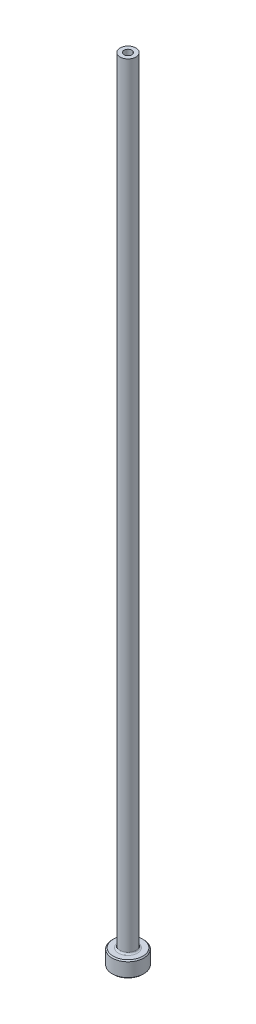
SolidWorks part; units mm, degrees
ref_plane "Front Plane" through (0, 0, 0) normal (0, 0, 1) x (1, 0, 0)
ref_plane "Top Plane" through (0, 0, 0) normal (0, 1, 0) x (1, 0, 0)
ref_plane "Right Plane" through (0, 0, 0) normal (1, 0, 0) x (0, 0, -1)
sketch "Sketch1" plane through (0, 0, 0) normal (0, 0, 1) x (1, 0, 0)
  line L0 (-0.75, 150) -> (-1.5, 150)
  line L1 (-1.5, 150) -> (-1.5, 3)
  line L2 (-1.5, 3) -> (-3, 3)
  line L3 (-3, 3) -> (-3, 0)
  line L4 (3.3, 0) -> (-3.3, 0) construction
  line L5 (-3, 0) -> (-1, 0)
  line L6 (-0.75, 115) -> (-0.75, 150)
  line L7 (0, 92.1877) -> (0, -15.5353) construction
  line L8 (0, -3.3) -> (0, 3.3) construction
  line L9 (-0.75, 115) -> (-1, 103)
  line L10 (-1, 103) -> (-1, 0)
  dimension "D1" = 0.25
  dimension "ID" = 1.5
  dimension "OD" = 3
  dimension "L" = 150
  dimension "H" = 6
  dimension "T" = 3
  dimension "N" = 35
  dimension "D2" = 12
revolve "Revolve1" add sketch "Sketch1" angle 360 about L7
fillet "Fillet1" radius 0.3 1 edges at (0, 3, 1.5)
chamfer "Chamfer1" distance 0.2 angle 45 2 edges at (0, 3, 3) (0, 0, 3)
chamfer "Chamfer3" distance 0.5 angle 45 1 edges at (0, 0, 1)
